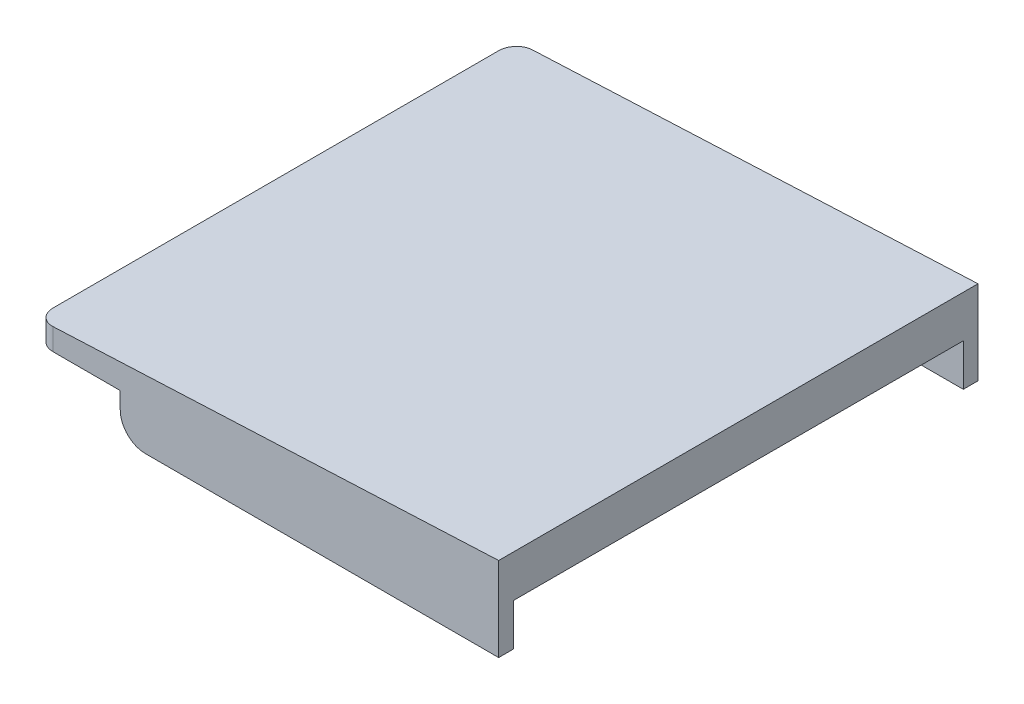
SolidWorks part; units mm, degrees
ref_plane "Plan de face" through (0, 0, 0) normal (0, 0, 1) x (1, 0, 0)
ref_plane "Plan de dessus" through (0, 0, 0) normal (0, 1, 0) x (1, 0, 0)
ref_plane "Plan de droite" through (0, 0, 0) normal (1, 0, 0) x (0, 0, -1)
sketch "Esquisse4" plane through (0, 0, 0) normal (0, 0, 1) x (1, 0, 0)
  line L0 (0, 2.5) -> (55, 5)
  line L1 (0, 0) -> (55, 0)
  line L2 (0, 0) -> (0, 2.5)
  line L4 (55, 0) -> (55, 5)
  dimension "D1" = 5
  dimension "D2" = 55
extrude "Extrusion2" add sketch "Esquisse4" along normal blind 57
shell "Coque1" thickness 2
fillet "Congé1" radius 2 2 edges at (0, 1.25, 57) (0, 1.25, 0)
sketch "Esquisse8" plane through (0, 0, 0) normal (0, -1, 0) x (1, 0, 0)
  line L0 (55, 57) -> (55, 0) construction
  line L1 (55, 1.75) -> (10, 1.75)
  line L2 (55, 57) -> (55, 55.25)
  line L3 (55, 0) -> (10, 0)
  line L4 (10, 1.75) -> (10, 0)
  line L5 (55, 28.5) -> (0, 28.5) construction
  line L6 (0, 55) -> (0, 2) construction
  line L7 (2, 0) -> (55, 0) construction
  line L8 (10, 55.25) -> (10, 57)
  line L9 (55, 57) -> (10, 57)
  line L10 (10, 55.25) -> (55, 55.25)
  line L11 (55, 1.75) -> (55, 0)
  dimension "D1" = 1.75
  dimension "D3" = 45
extrude "Extrusion5" add sketch "Esquisse8" along normal blind 5
fillet "Congé2" radius 3 3 edges at (10, -5, 0.875) (10, -5, 56.125)
